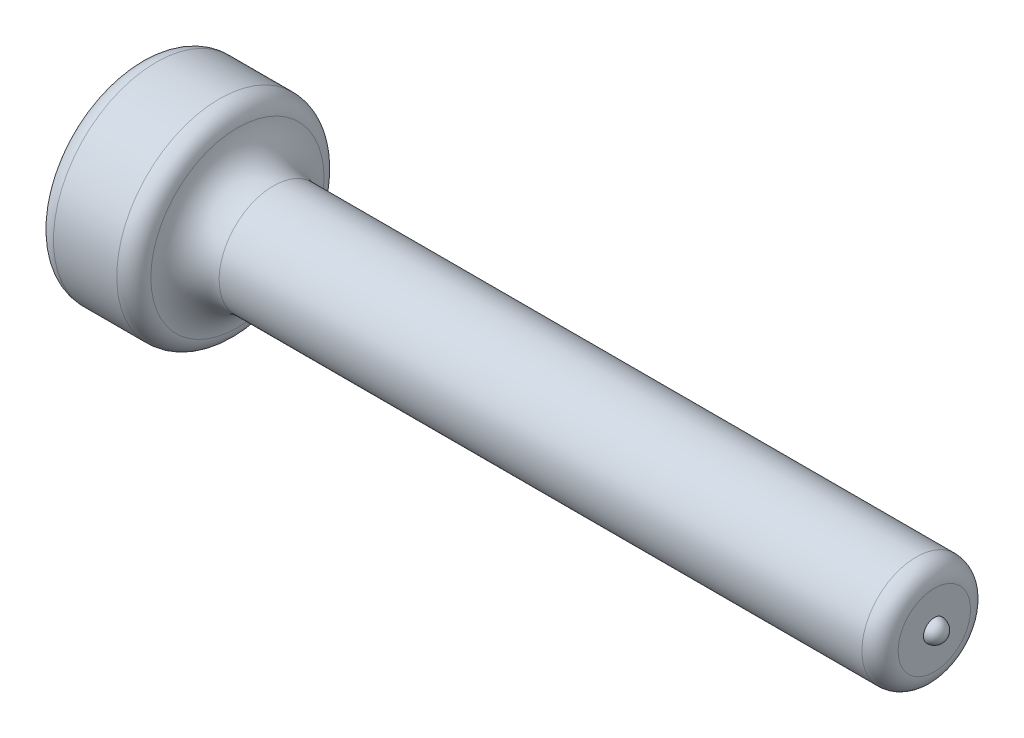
SolidWorks part; units mm, degrees
ref_plane "Front" through (0, 0, 0) normal (0, 0, 1) x (1, 0, 0)
ref_plane "Top" through (0, 0, 0) normal (0, 1, 0) x (1, 0, 0)
ref_plane "Right" through (0, 0, 0) normal (1, 0, 0) x (0, 0, -1)
sketch "Sketch1" plane through (26.6046, 20.9296, 0) normal (0, 0, 1) x (0, 1, 0)
  line L0 (-20.9296, -17.3954) -> (-17.9296, -17.3954)
  line L1 (-17.9296, -17.3954) -> (-17.9296, 21.1246)
  line L2 (-17.9296, 21.1246) -> (-15.2546, 21.1246)
  line L3 (-15.2546, 21.1246) -> (-15.2546, 26.6046)
  line L4 (-15.2546, 26.6046) -> (-20.9296, 26.6046)
  line L5 (-20.9296, 26.6046) -> (-20.9296, -17.3954)
  line L6 (-20.9296, 63.1371) -> (-20.9296, -15.6029) construction
  dimension "K" = 5.48
  dimension "l" = 44
  dimension "d" = 6
  dimension "dk" = 11.35
revolve "Base-Revolve" add sketch "Sketch1" angle 360 about L6
fillet "Fillet1" radius 2 1 edges at (5.48, -3, 0)
fillet "Fillet2" radius 1 1 edges at (44, -3, 0)
fillet "Fillet3" radius 1 2 edges at (5.48, -5.675, 0) (0, -5.675, 0)
sketch "Sketch2" plane through (0, 0, 0) normal (0, 0, 1) x (1, 0, 0)
  line L0 (0, 0) -> (45.2246, 0) construction
  line L1 (44, -2) -> (44, 2) construction
  line L2 (43.4, 0) -> (44.6, 0)
  arc A0 (44.6, 0) -> (43.4, 0) centre (44, 0) ccw
  dimension "D1" = 0.6
revolve "Revolve1" add sketch "Sketch2" angle 360 about L0
sketch "Sketch3" plane through (0, 0, 0) normal (0, 0, 1) x (1, 0, 0)
  line L0 (0, 4.675) -> (0, -4.675) construction
  line L1 (0, 0) -> (1.096, 0)
  line L2 (0, 0) -> (0, 3.7833)
  line L3 (0, 3.7833) -> (1.096, 3.7833)
  line L4 (1.096, 0) -> (1.096, 3.7833)
  line L5 (0, 0) -> (-2.8633, 0) construction
  dimension "D1" = 1.096
  dimension "D2" = 7.5667
revolve "Cut-Revolve1" cut sketch "Sketch3" angle 360 about L5
equation "\"D1@Fillet2\"=\"r@Fillet1\"/2"
equation "\"D1@Fillet3\"=\"r@Fillet1\" / 2"
equation "\"D1@Sketch2\" = \"d@Sketch1\" / 10"
equation "\"D1@Sketch3\" = \"K@Sketch1\" / 5"
equation "\"D2@Sketch3\" = \"dk@Sketch1\" *2 /3"
